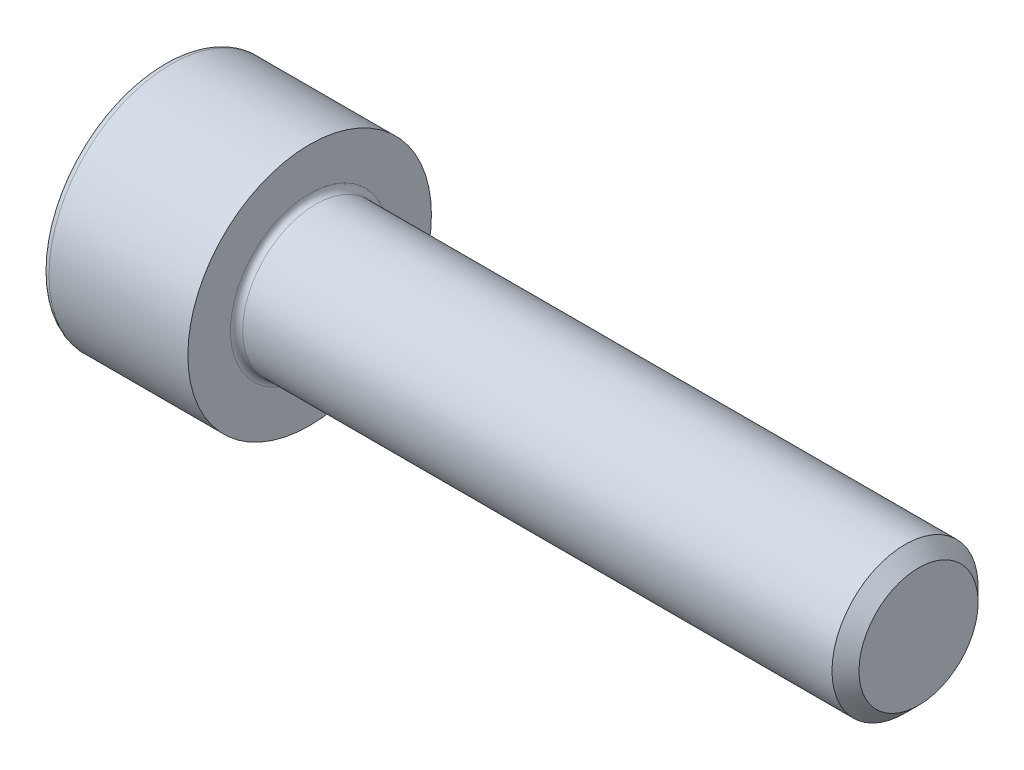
SolidWorks part; units mm, degrees
revolve "Base-Revolve" add sketch "BodySke"
sketch "BodySke" plane through (0, 0, 0) normal (0, 0, 1) x (1, 0, 0)
  line L0 (0, 0) -> (0, 5)
  line L1 (0, 5) -> (6, 5)
  line L2 (6, 5) -> (6, 3)
  line L3 (6, 3) -> (30.4455, 3)
  line L4 (31, 2.4455) -> (31, 0)
  line L5 (31, 0) -> (0, 0)
  line L6 (-31.75, 0) -> (127, 0) construction
  line L8 (31, 2.4455) -> (30.4455, 3)
  line L10 (31, -2.4455) -> (30.4455, -3) construction
  line L11 (7, 9.525) -> (7, 3.175) construction
  line L12 (6, 9.525) -> (6, 3.175) construction
  line L13 (-29, 9.525) -> (-29, 3.175) construction
fillet "Fillet1" radius 0.25 1 edges at (6, 0, 3)
fillet "Fillet2" radius 0.3 1 edges at (0, 0, 5)
ref_plane "Plane1" through (0, 0, 0) normal (0, 0, 1) x (1, 0, 0)
ref_plane "Plane2" through (0, 0, 0) normal (0, 1, 0) x (1, 0, 0)
ref_plane "Plane3" through (0, 0, 0) normal (1, 0, 0) x (0, 0, -1)
sketch "Sketch2" plane through (0, 0, 0) normal (0, 0, 1) x (1, 0, 0)
  line L0 (0, 2.542) -> (3, 2.542)
  line L1 (3, 2.542) -> (4.4676, 0)
  line L2 (-31.75, 0) -> (127, 0) construction
  line L3 (4.4676, 0) -> (0, 0)
  line L4 (0, 0) -> (0, 2.542)
  line L6 (0, 0) -> (47.625, 0) construction
revolve "Hex-PreBroach" cut sketch "Sketch2" angle 360 about L6
sketch "Sketch3" plane through (0, 0, 0) normal (-1, 0, 0) x (0, 0.5, 0.866)
  line L0 (1.4676, 2.542) -> (-1.4676, 2.542)
  line L1 (-1.4676, 2.542) -> (-2.9352, 0)
  line L2 (1.4676, 2.542) -> (2.9352, 0)
  line L3 (1.4676, -2.542) -> (2.9352, 0)
  line L4 (1.4676, -2.542) -> (-1.4676, -2.542)
  line L5 (-1.4676, -2.542) -> (-2.9352, 0)
extrude "Hex" cut sketch "Sketch3" against normal blind 3
sketch "ThdSchSke" plane through (0, 0, 0) normal (0, 0, 1) x (1, 0, 0)
  line L0 (9, -2.4455) -> (8.6117, -3)
  line L1 (9, -2.4455) -> (9.3883, -3)
  line L2 (9.3883, -3) -> (9.3883, -3.75)
  line L3 (-3.175, 0) -> (5.1513, 0) construction
  line L4 (0, 4.7) -> (0, -4.7) construction
  line L5 (9.3883, -3.75) -> (8.6117, -3.75)
  line L6 (8.6117, -3.75) -> (8.6117, -3)
revolve "ThreadSchematic" [suppressed] cut sketch "ThdSchSke" angle 360 about L3
pattern_linear "ThdSchPat" [suppressed]
equation "\"D2@Sketch3\" = \"Hex_size@Sketch3\" / 2"
equation "\"D1@Sketch3\" = \"Hex_size@Sketch3\" / 2"
equation "\"D1@Sketch2\" = \"Hex_size@Sketch3\" / 2"
equation "\"Thread_minor@ThreadCosmetic\"  =  \"Minor_dia@BodySke\""
equation "\"Depth@Sketch2\" =  \"Key_eng@Hex\""
equation "\"Thread_length@ThreadCosmetic\" = ((sgn( (\"Length@BodySke\" - \"Advance@BodySke\" * 3.0) - \"Thread_nom@BodySke\" )-1)*( (\"Length@BodySke\" - \"Advance@BodySke\" * 3.0) - \"Thread_nom@BodySke\" ))/-2+ \"Thread_no"
equation "\"Thread_minor@ThdSchSke\" = \"Minor_dia@BodySke\""
equation "\"Diameter@ThdSchSke\" = \"Diameter@BodySke\""
equation "\"Overcut@ThdSchSke\" = \"Diameter@BodySke\" * 1.25"
equation "\"Start@ThdSchSke\" = \"Head_ht@BodySke\" + \"Length@BodySke\" - \"Thread_length@ThreadCosmetic\"  '---Non-countersunk---"
equation "\"Num_threads@ThdSchPat\" = int( \"Thread_length@ThreadCosmetic\" / \"Advance@BodySke\" + 0.999 )  + 1"
equation "\"Advance@ThdSchPat\" = \"Thread_length@ThreadCosmetic\" /  (\"Num_threads@ThdSchPat\" - 1) 'relax it"
equation "\"Num_threads@ThdSchPat\" = \"Num_threads@ThdSchPat\" - sgn( \"Num_threads@ThdSchPat\" - 1) '---chamfered tips only---"
